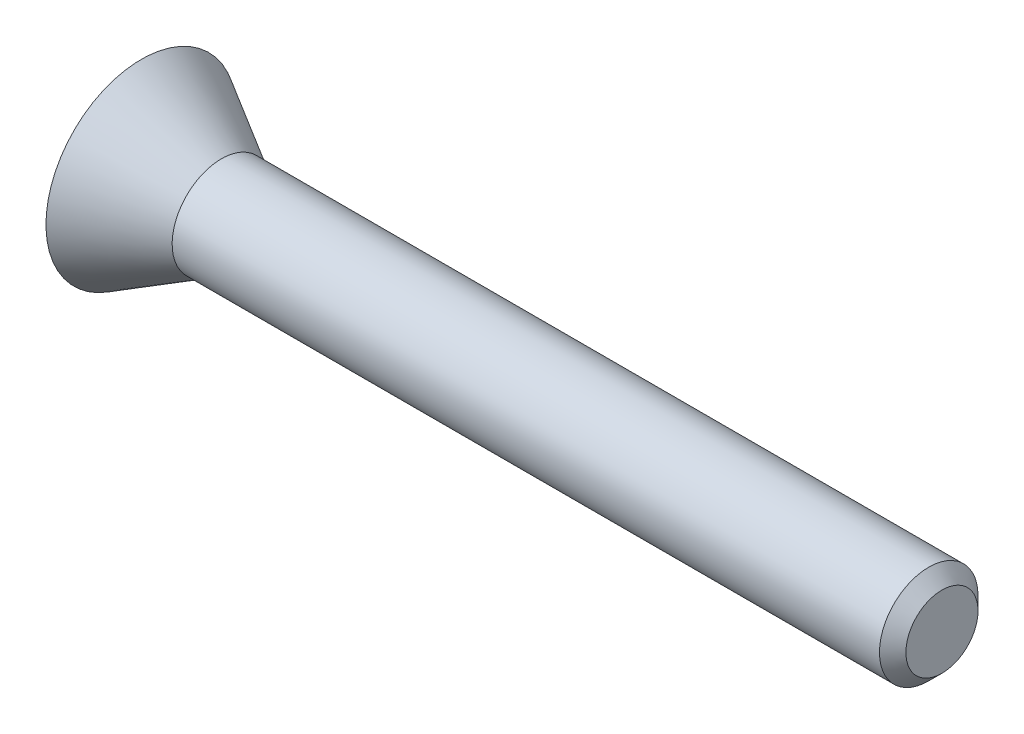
SolidWorks part; units mm, degrees
ref_plane "Front Plane" through (0, 0, 0) normal (0, 0, 1) x (1, 0, 0)
ref_plane "Top Plane" through (0, 0, 0) normal (0, 1, 0) x (1, 0, 0)
ref_plane "Right Plane" through (0, 0, 0) normal (1, 0, 0) x (0, 0, -1)
sketch "Sketch1" plane through (0, 0, 0) normal (1, 0, 0) x (0, 0, -1)
  circle A0 centre (0, 0) radius 1.55
  dimension "D1" = 3.1
extrude "Boss-Extrude1" add sketch "Sketch1" along normal mid plane 13 contours A0
sketch "Sketch2" plane through (0, 0, 0) normal (0, 0, 1) x (1, 0, 0)
  line L0 (-5.201, 0.8) -> (6.5, 0.8)
  line L1 (6.5, -1.55) -> (6.5, 1.55) construction
  line L2 (6.5, 0.8) -> (6.5, 1.55)
  line L3 (-5.201, 0.8) -> (-6.5, 1.55)
  line L4 (-6.5, 1.55) -> (6.5, 1.55)
  line L5 (-6.5, 1.55) -> (-6.5, -1.55) construction
  line L6 (-6.5, 0) -> (6.5, 0) construction
  dimension "D1" = 30
  dimension "D2" = 1.6
revolve "Cut-Revolve1" cut sketch "Sketch2" angle 360 about L6
sketch "Sketch3" plane through (-6.5, 0, 0) normal (-1, 0, 0) x (0, 0, 1)
  line L1 (0.155, 0.68) -> (0.155, -1.025)
  line L2 (0.37, 0.68) -> (0.155, 0.68)
  line L3 (0, 1.3) -> (0.37, 0.68)
  line L4 (0, 1.3) -> (-0.37, 0.68)
  line L5 (-0.37, 0.68) -> (-0.155, 0.68)
  line L6 (-0.155, 0.68) -> (-0.155, -1.025)
  line L7 (0, 1.55) -> (0, -1.55) construction
  arc A0 (-0.155, -1.025) -> (0.155, -1.025) centre (0, -1.025) ccw
  circle A1 centre (0, 0) radius 1.55 construction
  dimension "D6" = 0.31
  dimension "D2" = 0.37
  dimension "D3" = 0.74
  dimension "D1" = 0.25
  dimension "D5" = 0.62
extrude "Cut-Extrude1" cut sketch "Sketch3" against normal blind 0.4
chamfer "Chamfer1" distance 0.2145 angle 45 1 edges at (6.5, -0.8, 0)
sketch "Sketch4" plane through (-6.5, 0, 0) normal (-1, 0, 0) x (0, 0, 1)
  text T0 "2  6" font "Bahnschrift" height 1.2
  dimension "D1" = 0.75
extrude "Cut-Extrude2" cut sketch "Sketch4" against normal blind 0.4
